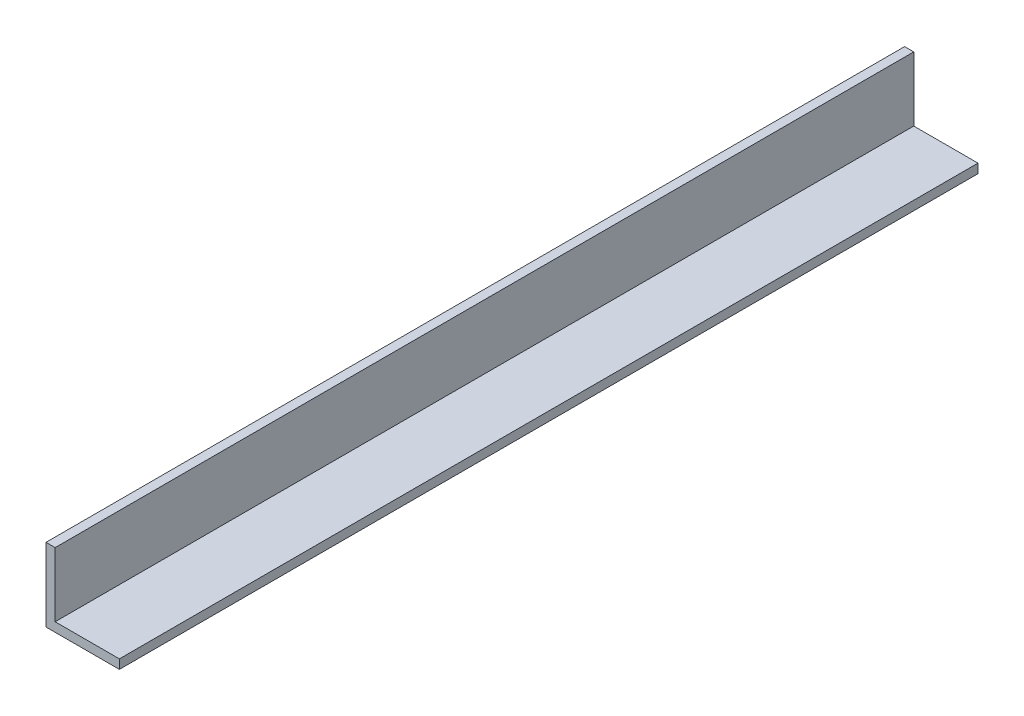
SolidWorks part; units mm, degrees
ref_plane "Front Plane" through (0, 0, 0) normal (0, 0, 1) x (1, 0, 0)
ref_plane "Top Plane" through (0, 0, 0) normal (0, 1, 0) x (1, 0, 0)
ref_plane "Right Plane" through (0, 0, 0) normal (1, 0, 0) x (0, 0, -1)
sketch "Sketch1" plane through (0, 0, 0) normal (0, 0, 1) x (1, 0, 0)
  line L0 (0, 0) -> (0, 38.1)
  line L1 (0, 0) -> (38.1, 0)
  line L2 (38.1, 0) -> (38.1, 4.7498)
  line L3 (38.1, 4.7498) -> (4.7498, 4.7498)
  line L4 (4.7498, 4.7498) -> (4.7498, 38.1)
  line L5 (4.7498, 38.1) -> (0, 38.1)
  dimension "D1" = 38.1
  dimension "D2" = 38.1
  dimension "D3" = 4.7498
  dimension "D4" = 4.7498
extrude "Boss-Extrude1" add sketch "Sketch1" along normal blind 445.77
